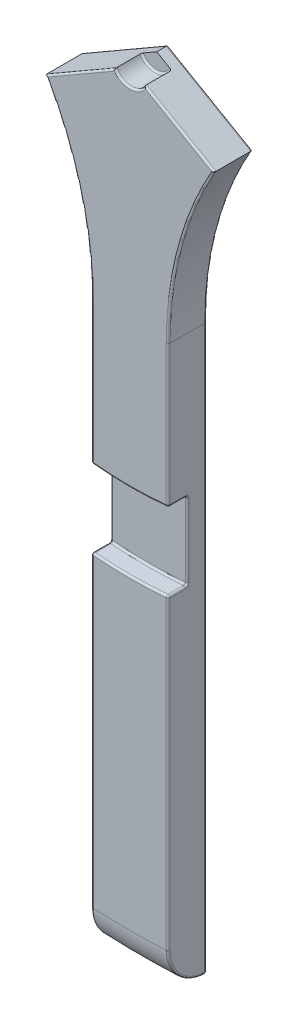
SolidWorks part; units mm, degrees
ref_plane "Спереди" through (0, 0, 0) normal (0, 0, 1) x (1, 0, 0)
ref_plane "Сверху" through (0, 0, 0) normal (0, 1, 0) x (1, 0, 0)
ref_plane "Справа" through (0, 0, 0) normal (1, 0, 0) x (0, 0, -1)
sketch "Эскиз1" plane through (0, 0, 0) normal (0, 0, 1) x (1, 0, 0)
  line L0 (0, 0) -> (0, -205) construction
  line L1 (-10, -57.6091) -> (-10, -204.756)
  line L2 (0, 0) -> (-22.0285, -12.7182)
  line L3 (10, -57.6091) -> (10, -204.756)
  line L4 (0, 0) -> (22.0285, -12.7182)
  arc A0 (-10, -204.756) -> (10, -204.756) centre (0, 0) ccw
  circle A1 centre (0, 0) radius 25 construction
  arc A2 (-10, -57.6091) -> (-22.0285, -12.7182) centre (-99.7818, -57.6091) ccw
  arc A4 (10, -57.6091) -> (22.0285, -12.7182) centre (99.7818, -57.6091) cw
  dimension "D1" = 410
  dimension "D4" = 50
  dimension "D2" = 20
  dimension "D3" = 60
extrude "Бобышка-Вытянуть1" add sketch "Эскиз1" along normal blind 10
sketch "Эскиз3" plane through (0, 0, 10) normal (0, 0, 1) x (1, 0, 0)
  circle A0 centre (0, 0) radius 4.5
  dimension "D1" = 9
extrude "Вырез-Вытянуть2" cut sketch "Эскиз3" against normal blind 7
sketch "Эскиз5" plane through (0, 0, 10) normal (0, 0, 1) x (1, 0, 0)
  line L0 (-10, -57.6091) -> (-10, -204.756) construction
  line L1 (-10, -94.4722) -> (-10, -114.5644)
  line L2 (10, -204.756) -> (10, -57.6091) construction
  line L3 (10, -114.5644) -> (10, -94.4722)
  arc A0 (-10, -114.5644) -> (10, -114.5644) centre (0, 0) ccw
  arc A1 (-10, -94.4722) -> (10, -94.4722) centre (0, 0) ccw
  circle A2 centre (0, 0) radius 95 construction
  circle A3 centre (0, 0) radius 115 construction
  dimension "D1" = 230
  dimension "D2" = 20
extrude "Вырез-Вытянуть3" cut sketch "Эскиз5" against normal blind 5
fillet "Скругление2" radius 10 1 edges at (0, -205, 10)
fillet "Скругление3" radius 0.5 29 edges at (-13.0592, -34.3718, 10) (-13.0592, -34.3718, 0) (13.0592, -34.3718, 10) (13.0592, -34.3718, 0) (0, -115, 5) (0, -95, 5) (-10, -76.0406, 10) (-10, -94.4722, 7.5) (-10, -104.5183, 5) (-10, -114.5644, 7.5) (-10, -154.6539, 10) (-10, -131.1825, 0) (10, -114.5644, 7.5) (10, -104.5183, 5) (10, -94.4722, 7.5) (10, -76.0406, 10) (10, -131.1825, 0) (10, -154.6539, 10) (0, -4.5, 3) (0, -4.5, 10) (-11.0142, -6.3591, 0) (11.0142, -6.3591, 0) (-12.9628, -7.4841, 10) (12.9628, -7.4841, 10) (0, -95, 10) (0, -115, 10) (-10, -202.5666, 6.2413) (10, -201.0043, 7.8039) (0, -205, 0)
